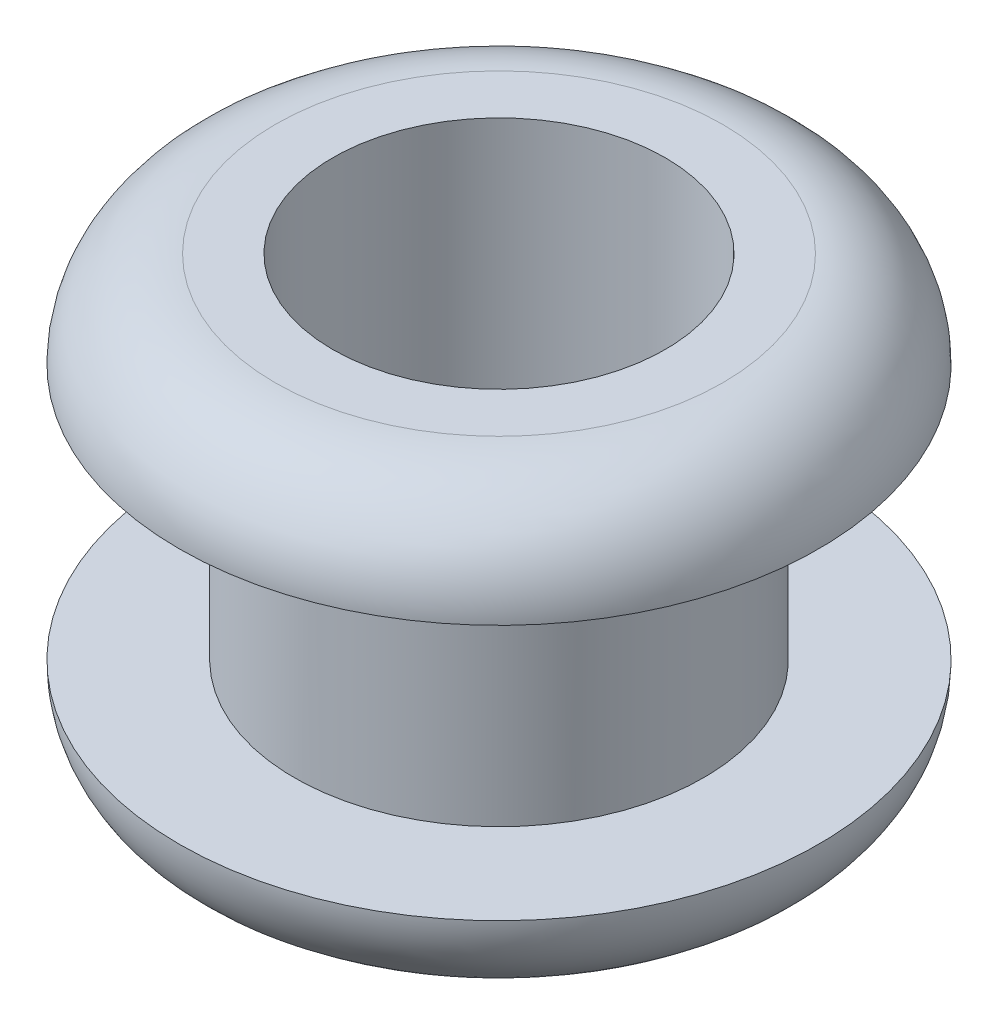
SolidWorks part; units mm, degrees
ref_plane "Front" through (0, 0, 0) normal (0, 0, 1) x (1, 0, 0)
ref_plane "Top" through (0, 0, 0) normal (0, 1, 0) x (1, 0, 0)
ref_plane "Right" through (0, 0, 0) normal (1, 0, 0) x (0, 0, -1)
sketch "Sketch1" plane through (0, 0, 0) normal (0, 1, 0) x (1, 0, 0)
  circle A0 centre (0, 0) radius 1.6
  circle A1 centre (0, 0) radius 1.3
extrude "Extrude1" add sketch "Sketch1" along normal blind 2
sketch "Sketch2" plane through (0, 2, 0) normal (0, 1, 0) x (-1, 0, 0)
  circle A0 centre (0, 0) radius 2.5
extrude "Extrude2" add sketch "Sketch2" along normal blind 0.75
sketch "Sketch3" plane through (0, 0, 0) normal (0, -1, 0) x (1, 0, 0)
  circle A0 centre (0, 0) radius 2.5
extrude "Extrude3" add sketch "Sketch3" along normal blind 0.75
sketch "Sketch4" plane through (0, -0.75, 0) normal (0, -1, 0) x (1, 0, 0)
  circle A0 centre (0, 0) radius 1.3
extrude "Cut-Extrude1" cut sketch "Sketch4" against normal through all
fillet "Fillet1" radius 0.75 2 edges at (0, -0.75, -2.5) (0, 2.75, 2.5)
